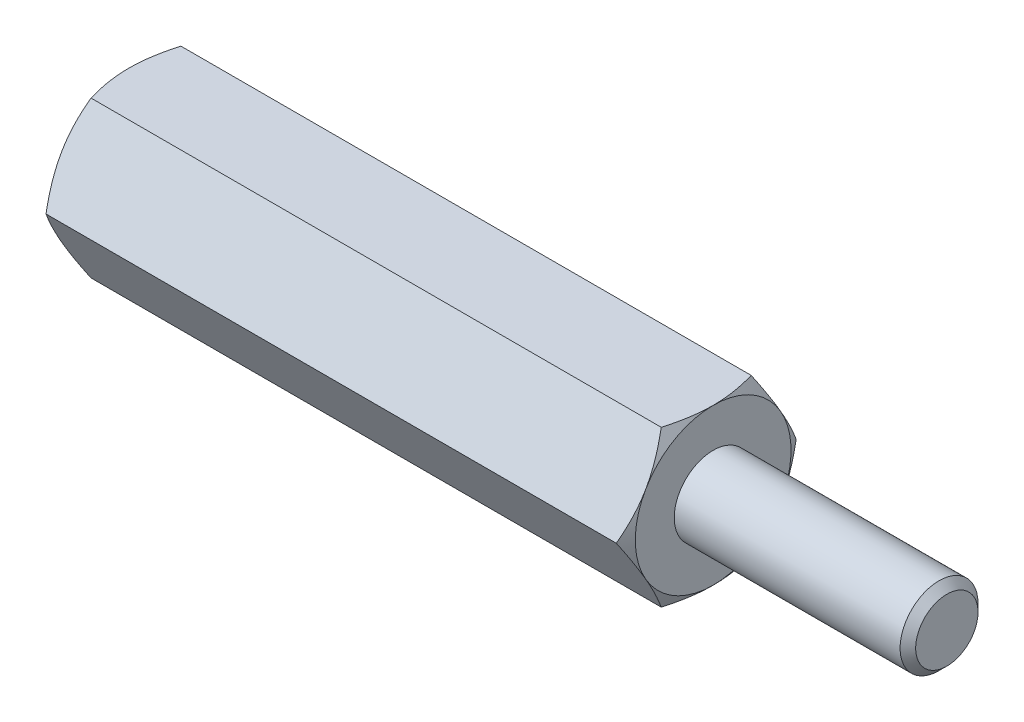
SolidWorks part; units mm, degrees
ref_plane "Front Plane" through (0, 0, 0) normal (0, 0, 1) x (1, 0, 0)
ref_plane "Top Plane" through (0, 0, 0) normal (0, 1, 0) x (1, 0, 0)
ref_plane "Right Plane" through (0, 0, 0) normal (1, 0, 0) x (0, 0, -1)
sketch "Sketch1" plane through (0, 0, 0) normal (1, 0, 0) x (0, 0, -1)
  line L1 (1.1547, 2) -> (-1.1547, 2)
  line L2 (-1.1547, 2) -> (-2.3094, 0)
  line L3 (-2.3094, 0) -> (-1.1547, -2)
  line L4 (-1.1547, -2) -> (1.1547, -2)
  line L5 (1.1547, -2) -> (2.3094, 0)
  line L6 (2.3094, 0) -> (1.1547, 2)
  circle A0 centre (0, 0) radius 2 construction
  dimension "D1" = 4
extrude "Extrude2" add sketch "Sketch1" along normal mid plane 15
sketch "Sketch2" plane through (0, 0, 0) normal (0, 0, 1) x (1, 0, 0)
  line L0 (-7.5, 2) -> (-6, 4.5981)
  line L1 (-7.5, 5) -> (-7.5, 2)
  line L3 (0, 0) -> (50000, 0) construction
  arc A0 (-6, 4.5981) -> (-7.5, 5) centre (-6.6962, 5) ccw
  dimension "D1" = 30
  dimension "D2" = 3
revolve "Cut-Revolve1" cut sketch "Sketch2" angle 360 about L3
mirror "Mirror1" about plane through (0, 0, 0) normal (1, 0, 0) of "Cut-Revolve1"
sketch "Sketch3" plane through (-7.5, 0, 0) normal (-1, 0, 0) x (0, 0, 1)
  circle A0 centre (0, 0) radius 0.8
  dimension "D1" = 1.6
extrude "Extrude3" cut sketch "Sketch3" against normal blind 6
sketch "Sketch4" plane through (0, 0, 0) normal (0, 0, 1) x (1, 0, 0)
  line L0 (-1.5, 0) -> (-1.5, 0.8)
  line L1 (7.3214, 0) -> (-7.3214, 0) construction
  line L2 (-1.5, 0.8) -> (-1.0381, 0)
  line L3 (-1.0381, 0) -> (-1.5, 0)
  line L4 (-7.5, 1) -> (-7.5, -1) construction
  point P4 (-7.5, 0)
  dimension "D1" = 30
  dimension "D2" = 0.8
  dimension "D3" = 6
revolve "Cut-Revolve2" cut sketch "Sketch4" angle 360 about L3
sketch "Sketch5" plane through (7.5, 0, 0) normal (1, 0, 0) x (0, 0, -1)
  circle A0 centre (0, 0) radius 1
  dimension "D1" = 2
extrude "Extrude4" add sketch "Sketch5" along normal blind 6
chamfer "Chamfer1" distance 0.2 angle 45 1 edges at (13.5, 0, -1)
equation "\"D2@Sketch4\" = \"D1@Sketch3\"/2"
